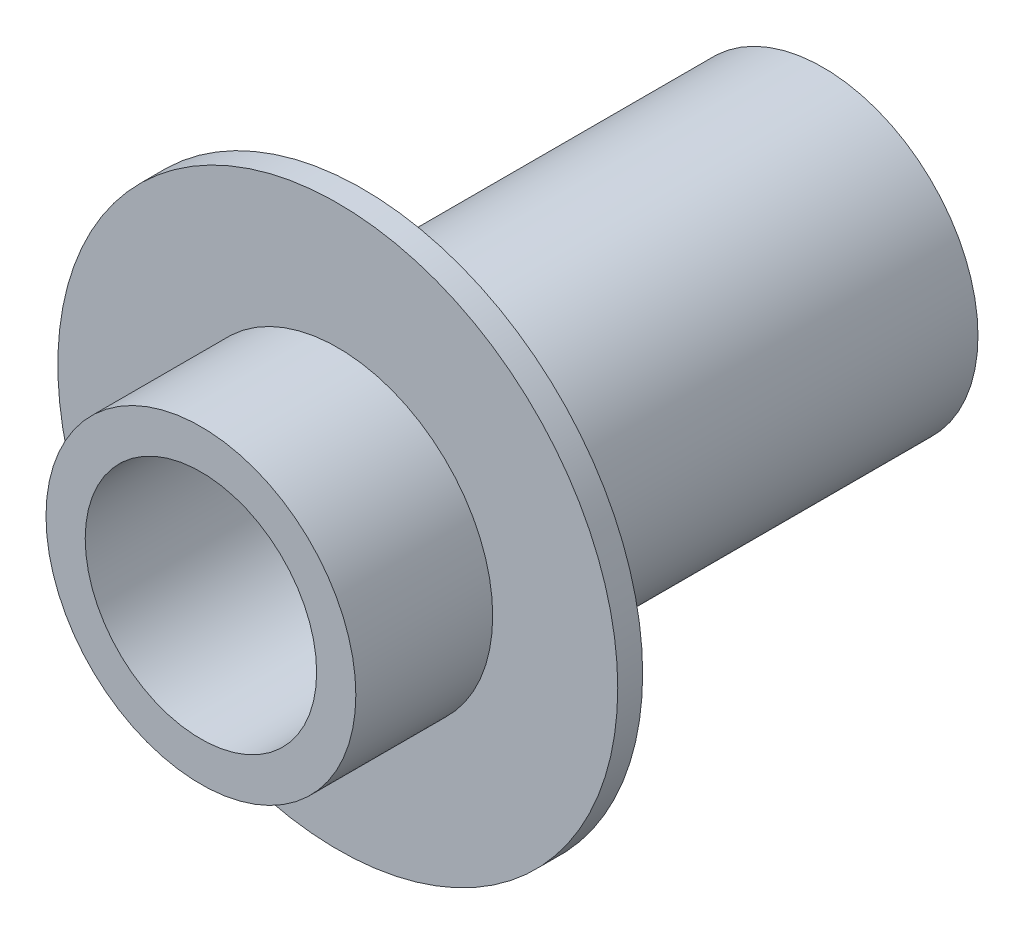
SolidWorks part; units mm, degrees
ref_plane "Front" through (0, 0, 0) normal (0, 0, 1) x (1, 0, 0)
ref_plane "Top" through (0, 0, 0) normal (0, 1, 0) x (1, 0, 0)
ref_plane "Right" through (0, 0, 0) normal (1, 0, 0) x (0, 0, -1)
sketch "Sketch1" plane through (0, 0, 0) normal (0, 0, 1) x (1, 0, 0)
  circle A0 centre (0, 0) radius 2.3622
  circle A1 centre (0, 0) radius 3.1623
  dimension "D1" = 4.7244
  dimension "D2" = 6.3246
extrude "Base-Extrude" add sketch "Sketch1" along normal blind 9.398
sketch "Sketch2" plane through (0, 0, 9.398) normal (0, 0, 1) x (1, 0, 0)
  circle A0 centre (0, 0) radius 5.715
  circle A1 centre (0, 0) radius 2.3622 construction
  circle A2 centre (0, 0) radius 2.3622
  dimension "D1" = 11.43
extrude "Boss-Extrude1" add sketch "Sketch2" along normal blind 0.508
sketch "Sketch3" plane through (0, 0, 9.398) normal (0, 0, -1) x (-1, 0, 0)
  circle A0 centre (0, 0) radius 3.1623 construction
  circle A1 centre (0, 0) radius 3.1623
  circle A2 centre (0, 0) radius 2.3622 construction
  circle A3 centre (0, 0) radius 2.3622
extrude "Boss-Extrude2" add sketch "Sketch3" against normal blind 3.302
